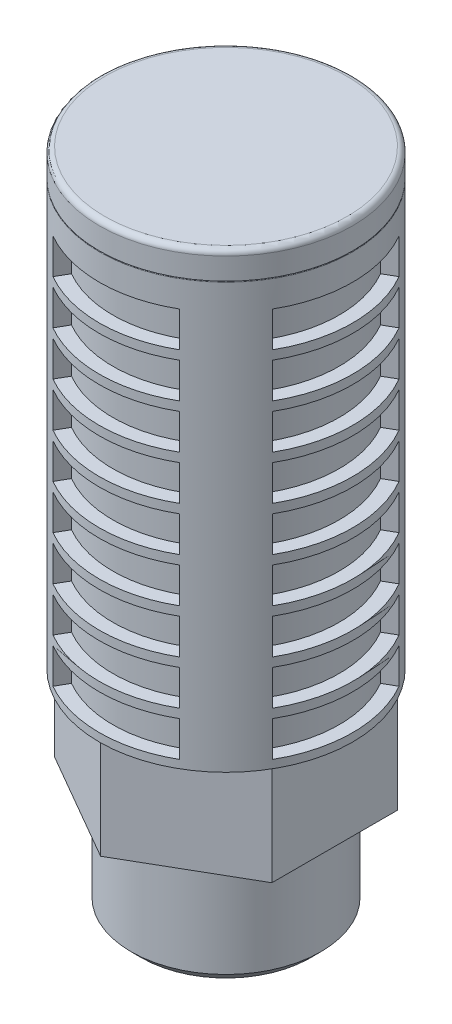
SolidWorks part; units mm, degrees
ref_plane "前视基准面" through (0, 0, 0) normal (0, 0, 1) x (1, 0, 0)
ref_plane "上视基准面" through (0, 0, 0) normal (0, 1, 0) x (1, 0, 0)
ref_plane "右视基准面" through (0, 0, 0) normal (1, 0, 0) x (0, 0, -1)
sketch "草图1" plane through (0, 0, 0) normal (0, 0, 1) x (1, 0, 0)
  line L0 (0, 73) -> (13.4, 73)
  line L1 (14, 72.4) -> (14, 70)
  line L2 (14, 70) -> (13.9, 70)
  line L3 (14, 69.9) -> (14, 23)
  line L4 (14, 23) -> (13.8564, 23)
  line L5 (13.8564, 23) -> (13.8564, 12)
  line L6 (13.8564, 12) -> (10.4775, 12)
  line L7 (10.4775, 12) -> (10.4775, 1.162)
  line L8 (10.4775, 1.162) -> (9.3155, 0)
  line L9 (9.3155, 0) -> (5.2387, 0)
  line L10 (5.2387, 0) -> (5.2387, 68)
  line L11 (5.2387, 68) -> (0, 71.0246)
  line L12 (0, 71.0246) -> (0, 73)
  line L13 (0, 0) -> (0, 73) construction
  arc A0 (13.4, 73) -> (14, 72.4) centre (13.4, 72.4) cw
  arc A1 (13.9, 70) -> (14, 69.9) centre (13.9, 69.9) cw
revolve "旋转1" add sketch "草图1" angle 360 about L13
sketch "草图2" plane through (0, 0, 0) normal (0, 0, 1) x (1, 0, 0)
  line L0 (12.5, 23.9) -> (28, 23.9)
  line L1 (28, 23.9) -> (28, 67)
  line L2 (28, 67) -> (12.5, 67)
  line L3 (12.5, 67) -> (12.5, 63.1)
  line L4 (12.5, 63.1) -> (14, 63.1)
  line L5 (14, 63.1) -> (14, 62.1)
  line L6 (14, 62.1) -> (12.5, 62.1)
  line L7 (12.5, 62.1) -> (12.5, 58.2)
  line L8 (12.5, 58.2) -> (14, 58.2)
  line L9 (14, 58.2) -> (14, 57.2)
  line L10 (14, 57.2) -> (12.5, 57.2)
  line L11 (12.5, 57.2) -> (12.5, 53.3)
  line L12 (12.5, 53.3) -> (14, 53.3)
  line L13 (14, 53.3) -> (14, 52.3)
  line L14 (14, 52.3) -> (12.5, 52.3)
  line L15 (12.5, 52.3) -> (12.5, 48.4)
  line L16 (12.5, 48.4) -> (14, 48.4)
  line L17 (14, 48.4) -> (14, 47.4)
  line L18 (14, 47.4) -> (12.5, 47.4)
  line L19 (12.5, 47.4) -> (12.5, 43.5)
  line L20 (12.5, 43.5) -> (14, 43.5)
  line L21 (14, 43.5) -> (14, 42.5)
  line L22 (14, 42.5) -> (12.5, 42.5)
  line L23 (12.5, 42.5) -> (12.5, 38.6)
  line L24 (12.5, 38.6) -> (14, 38.6)
  line L25 (14, 38.6) -> (14, 37.6)
  line L26 (14, 37.6) -> (12.5, 37.6)
  line L27 (12.5, 37.6) -> (12.5, 33.7)
  line L28 (12.5, 33.7) -> (14, 33.7)
  line L29 (14, 33.7) -> (14, 32.7)
  line L30 (14, 32.7) -> (12.5, 32.7)
  line L31 (12.5, 32.7) -> (12.5, 28.8)
  line L32 (12.5, 28.8) -> (14, 28.8)
  line L33 (14, 28.8) -> (14, 27.8)
  line L34 (14, 27.8) -> (12.5, 27.8)
  line L35 (12.5, 27.8) -> (12.5, 23.9)
  line L36 (0, 23.9) -> (0, 62.1) construction
revolve "切除-旋转1" cut sketch "草图2" angle 30 about L36
sketch "草图3" plane through (0, 0, 0) normal (0, 0, 1) x (1, 0, 0)
  line L0 (-28, 67) -> (-28, 23.9)
  line L1 (-28, 23.9) -> (-12.5, 23.9)
  line L2 (-12.5, 23.9) -> (-12.5, 27.8)
  line L3 (-12.5, 27.8) -> (-14, 27.8)
  line L4 (-14, 27.8) -> (-14, 28.8)
  line L5 (-14, 28.8) -> (-12.5, 28.8)
  line L6 (-12.5, 28.8) -> (-12.5, 32.7)
  line L7 (-12.5, 32.7) -> (-14, 32.7)
  line L8 (-14, 32.7) -> (-14, 33.7)
  line L9 (-14, 33.7) -> (-12.5, 33.7)
  line L10 (-12.5, 33.7) -> (-12.5, 37.6)
  line L11 (-12.5, 37.6) -> (-14, 37.6)
  line L12 (-14, 37.6) -> (-14, 38.6)
  line L13 (-14, 38.6) -> (-12.5, 38.6)
  line L14 (-12.5, 38.6) -> (-12.5, 42.5)
  line L15 (-12.5, 42.5) -> (-14, 42.5)
  line L16 (-14, 42.5) -> (-14, 43.5)
  line L17 (-14, 43.5) -> (-12.5, 43.5)
  line L18 (-12.5, 43.5) -> (-12.5, 47.4)
  line L19 (-12.5, 47.4) -> (-14, 47.4)
  line L20 (-14, 47.4) -> (-14, 48.4)
  line L21 (-14, 48.4) -> (-12.5, 48.4)
  line L22 (-12.5, 48.4) -> (-12.5, 52.3)
  line L23 (-12.5, 52.3) -> (-14, 52.3)
  line L24 (-14, 52.3) -> (-14, 53.3)
  line L25 (-14, 53.3) -> (-12.5, 53.3)
  line L26 (-12.5, 53.3) -> (-12.5, 57.2)
  line L27 (-12.5, 57.2) -> (-14, 57.2)
  line L28 (-14, 57.2) -> (-14, 58.2)
  line L29 (-14, 58.2) -> (-12.5, 58.2)
  line L30 (-12.5, 58.2) -> (-12.5, 62.1)
  line L31 (-12.5, 62.1) -> (-14, 62.1)
  line L32 (-14, 62.1) -> (-14, 63.1)
  line L33 (-14, 63.1) -> (-12.5, 63.1)
  line L34 (-12.5, 63.1) -> (-12.5, 67)
  line L35 (-12.5, 67) -> (-28, 67)
  line L36 (0, 62.1) -> (0, 23.9) construction
revolve "切除-旋转2" cut sketch "草图3" angle 30 about L36
sketch "草图4" plane through (0, 0, 0) normal (1, 0, 0) x (0, 0, -1)
  line L0 (12.5, 23.9) -> (28, 23.9)
  line L1 (28, 23.9) -> (28, 67)
  line L2 (28, 67) -> (12.5, 67)
  line L3 (12.5, 67) -> (12.5, 63.1)
  line L4 (12.5, 63.1) -> (14, 63.1)
  line L5 (14, 63.1) -> (14, 62.1)
  line L6 (14, 62.1) -> (12.5, 62.1)
  line L7 (12.5, 62.1) -> (12.5, 58.2)
  line L8 (12.5, 58.2) -> (14, 58.2)
  line L9 (14, 58.2) -> (14, 57.2)
  line L10 (14, 57.2) -> (12.5, 57.2)
  line L11 (12.5, 57.2) -> (12.5, 53.3)
  line L12 (12.5, 53.3) -> (14, 53.3)
  line L13 (14, 53.3) -> (14, 52.3)
  line L14 (14, 52.3) -> (12.5, 52.3)
  line L15 (12.5, 52.3) -> (12.5, 48.4)
  line L16 (12.5, 48.4) -> (14, 48.4)
  line L17 (14, 48.4) -> (14, 47.4)
  line L18 (14, 47.4) -> (12.5, 47.4)
  line L19 (12.5, 47.4) -> (12.5, 43.5)
  line L20 (12.5, 43.5) -> (14, 43.5)
  line L21 (14, 43.5) -> (14, 42.5)
  line L22 (14, 42.5) -> (12.5, 42.5)
  line L23 (12.5, 42.5) -> (12.5, 38.6)
  line L24 (12.5, 38.6) -> (14, 38.6)
  line L25 (14, 38.6) -> (14, 37.6)
  line L26 (14, 37.6) -> (12.5, 37.6)
  line L27 (12.5, 37.6) -> (12.5, 33.7)
  line L28 (12.5, 33.7) -> (14, 33.7)
  line L29 (14, 33.7) -> (14, 32.7)
  line L30 (14, 32.7) -> (12.5, 32.7)
  line L31 (12.5, 32.7) -> (12.5, 28.8)
  line L32 (12.5, 28.8) -> (14, 28.8)
  line L33 (14, 28.8) -> (14, 27.8)
  line L34 (14, 27.8) -> (12.5, 27.8)
  line L35 (12.5, 27.8) -> (12.5, 23.9)
  line L36 (0, 23.9) -> (0, 62.1) construction
revolve "切除-旋转3" cut sketch "草图4" angle 30 about L36
sketch "草图5" plane through (0, 0, 0) normal (1, 0, 0) x (0, 0, -1)
  line L0 (-28, 67) -> (-28, 23.9)
  line L1 (-28, 23.9) -> (-12.5, 23.9)
  line L2 (-12.5, 23.9) -> (-12.5, 27.8)
  line L3 (-12.5, 27.8) -> (-14, 27.8)
  line L4 (-14, 27.8) -> (-14, 28.8)
  line L5 (-14, 28.8) -> (-12.5, 28.8)
  line L6 (-12.5, 28.8) -> (-12.5, 32.7)
  line L7 (-12.5, 32.7) -> (-14, 32.7)
  line L8 (-14, 32.7) -> (-14, 33.7)
  line L9 (-14, 33.7) -> (-12.5, 33.7)
  line L10 (-12.5, 33.7) -> (-12.5, 37.6)
  line L11 (-12.5, 37.6) -> (-14, 37.6)
  line L12 (-14, 37.6) -> (-14, 38.6)
  line L13 (-14, 38.6) -> (-12.5, 38.6)
  line L14 (-12.5, 38.6) -> (-12.5, 42.5)
  line L15 (-12.5, 42.5) -> (-14, 42.5)
  line L16 (-14, 42.5) -> (-14, 43.5)
  line L17 (-14, 43.5) -> (-12.5, 43.5)
  line L18 (-12.5, 43.5) -> (-12.5, 47.4)
  line L19 (-12.5, 47.4) -> (-14, 47.4)
  line L20 (-14, 47.4) -> (-14, 48.4)
  line L21 (-14, 48.4) -> (-12.5, 48.4)
  line L22 (-12.5, 48.4) -> (-12.5, 52.3)
  line L23 (-12.5, 52.3) -> (-14, 52.3)
  line L24 (-14, 52.3) -> (-14, 53.3)
  line L25 (-14, 53.3) -> (-12.5, 53.3)
  line L26 (-12.5, 53.3) -> (-12.5, 57.2)
  line L27 (-12.5, 57.2) -> (-14, 57.2)
  line L28 (-14, 57.2) -> (-14, 58.2)
  line L29 (-14, 58.2) -> (-12.5, 58.2)
  line L30 (-12.5, 58.2) -> (-12.5, 62.1)
  line L31 (-12.5, 62.1) -> (-14, 62.1)
  line L32 (-14, 62.1) -> (-14, 63.1)
  line L33 (-14, 63.1) -> (-12.5, 63.1)
  line L34 (-12.5, 63.1) -> (-12.5, 67)
  line L35 (-12.5, 67) -> (-28, 67)
  line L36 (0, 62.1) -> (0, 23.9) construction
revolve "切除-旋转4" cut sketch "草图5" angle 30 about L36
ref_plane "基准面1" through (0, 12, 0) normal (0, 1, 0) x (1, 0, 0)
sketch "草图6" plane through (0, 12, 0) normal (0, 1, 0) x (1, 0, 0)
  line L0 (-12, -6.9282) -> (0, -13.8564)
  line L1 (0, -13.8564) -> (12, -6.9282)
  line L2 (12, -6.9282) -> (12, 6.9282)
  line L3 (12, 6.9282) -> (0, 13.8564)
  line L4 (0, 13.8564) -> (-12, 6.9282)
  line L5 (-12, 6.9282) -> (-12, -6.9282)
  circle A0 centre (0, 0) radius 24
extrude "切除-拉伸1" cut sketch "草图6" along normal blind 11
